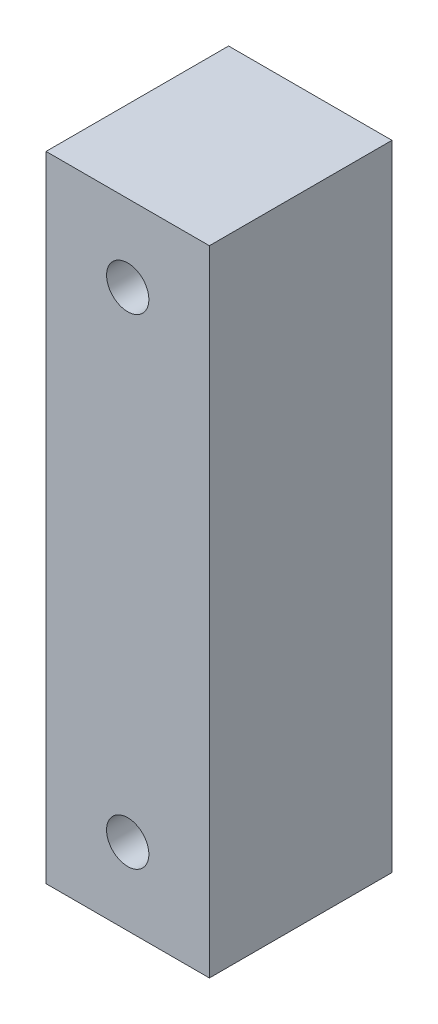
SolidWorks part; units mm, degrees
ref_plane "Front Plane" through (0, 0, 0) normal (1, 0, 0) x (0, 1, 0)
ref_plane "Top Plane" through (0, 0, 0) normal (0, 0, 1) x (0, 1, 0)
ref_plane "Right Plane" through (0, 0, 0) normal (0, 1, 0) x (-1, 0, 0)
sketch "Sketch1" plane through (0, 0, 0) normal (1, 0, 0) x (0, 1, 0)
  line L0 (-165, -83.5) -> (165, -83.5)
  line L1 (165, -83.5) -> (165, 11.5)
  line L4 (0, 11.5) -> (0, -83.5) construction
  line L5 (-165, -83.5) -> (-165, 11.5)
  line L8 (-165, 11.5) -> (165, 11.5)
  point P15 (0, -83.5)
  dimension "D1" = 95
  dimension "D4" = 165
extrude "Boss-Extrude1" add sketch "Sketch1" along normal blind 85
sketch "Sketch3" plane through (0, 0, 11.5) normal (0, 0, 1) x (1, 0, 0)
  line L0 (0, 0) -> (85, 0) construction
  line L1 (42.5, 0) -> (42.5, 125) construction
  line L2 (0, 165) -> (0, -165) construction
  line L3 (85, 165) -> (85, -165) construction
  circle A0 centre (42.5, 125) radius 11
  circle A1 centre (42.5, -125) radius 11
  dimension "D2" = 22
  dimension "D1" = 125
extrude "Cut-Extrude2" cut sketch "Sketch3" against normal blind 150
